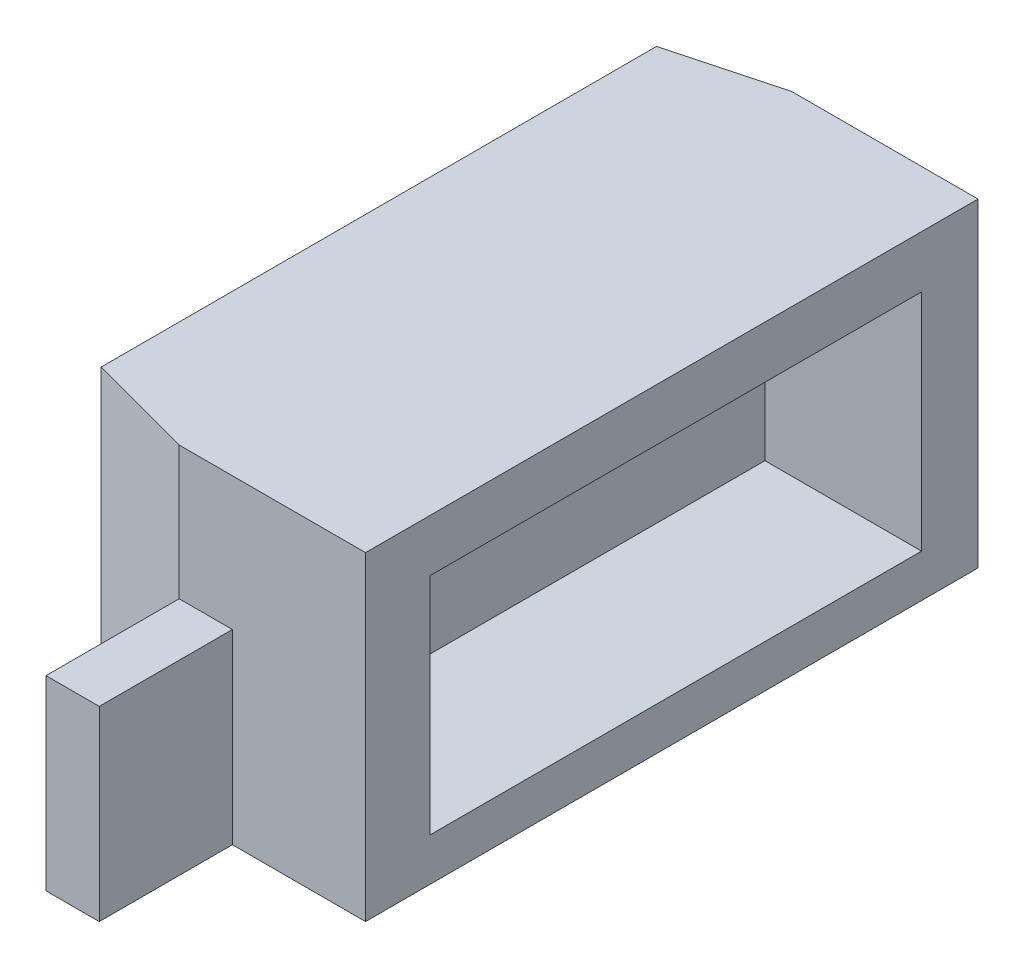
SolidWorks part; units mm, degrees
ref_plane "Front Plane" through (0, 0, 0) normal (0, 0, 1) x (1, 0, 0)
ref_plane "Top Plane" through (0, 0, 0) normal (0, 1, 0) x (1, 0, 0)
ref_plane "Right Plane" through (0, 0, 0) normal (1, 0, 0) x (0, 0, -1)
sketch "Sketch1" plane through (0, 0, 0) normal (0, 1, 0) x (1, 0, 0)
  line L1 (-0.55, -1.15) -> (0.55, -1.15)
  line L2 (-0.55, -1.15) -> (-0.55, 1.15)
  line L3 (-0.55, 1.15) -> (0.55, 1.15)
  line L4 (0.55, -1.15) -> (0.55, 1.15)
  line L5 (-0.55, -1.15) -> (0.55, 1.15) construction
  line L6 (-0.55, 1.15) -> (0.55, -1.15) construction
  point P0 (0, 0)
  dimension "D1" = 2.3
  dimension "D2" = 1.1
extrude "Boss-Extrude1" add sketch "Sketch1" along normal blind 1.2
sketch "Sketch2" plane through (0, 0, 0) normal (0, -1, 0) x (1, 0, 0)
  line L0 (-0.55, 1.15) -> (0.55, 1.15) construction
  line L1 (-0.15, 1.15) -> (0.05, 1.15)
  line L2 (-0.15, 1.15) -> (-0.15, 1.65)
  line L3 (-0.15, 1.65) -> (0.05, 1.65)
  line L4 (0.05, 1.15) -> (0.05, 1.65)
  line L5 (0.55, -1.15) -> (-0.55, -1.15) construction
  line L6 (-0.15, -1.15) -> (0.05, -1.15)
  line L7 (-0.15, -1.15) -> (-0.15, -1.65)
  line L8 (-0.15, -1.65) -> (0.05, -1.65)
  line L9 (0.05, -1.15) -> (0.05, -1.65)
  line L10 (-0.55, -1.15) -> (-0.55, 1.15) construction
  dimension "D1" = 0.2
  dimension "D2" = 0.2
  dimension "D3" = 0.5
  dimension "D4" = 0.5
  dimension "D5" = 0.4
  dimension "D6" = 0.4
extrude "Boss-Extrude2" add sketch "Sketch2" against normal blind 0.7
sketch "Sketch3" plane through (0.55, 0, 0) normal (1, 0, 0) x (0, 0, -1)
  line L1 (-0.9081, 1.0041) -> (0.938, 1.0041)
  line L2 (-0.9081, 1.0041) -> (-0.9081, 0.1609)
  line L3 (-0.9081, 0.1609) -> (0.938, 0.1609)
  line L4 (0.938, 1.0041) -> (0.938, 0.1609)
extrude "Cut-Extrude1" cut sketch "Sketch3" against normal blind 0.5
draft "Draft1" type of draft neutral plane draft angle 10 faces to draft 4 parameters "D1"=10
chamfer "Chamfer1" distance 0.4 angle 15 2 edges at (-0.55, 0.6, 1.15) (-0.55, 0.6, -1.15)
